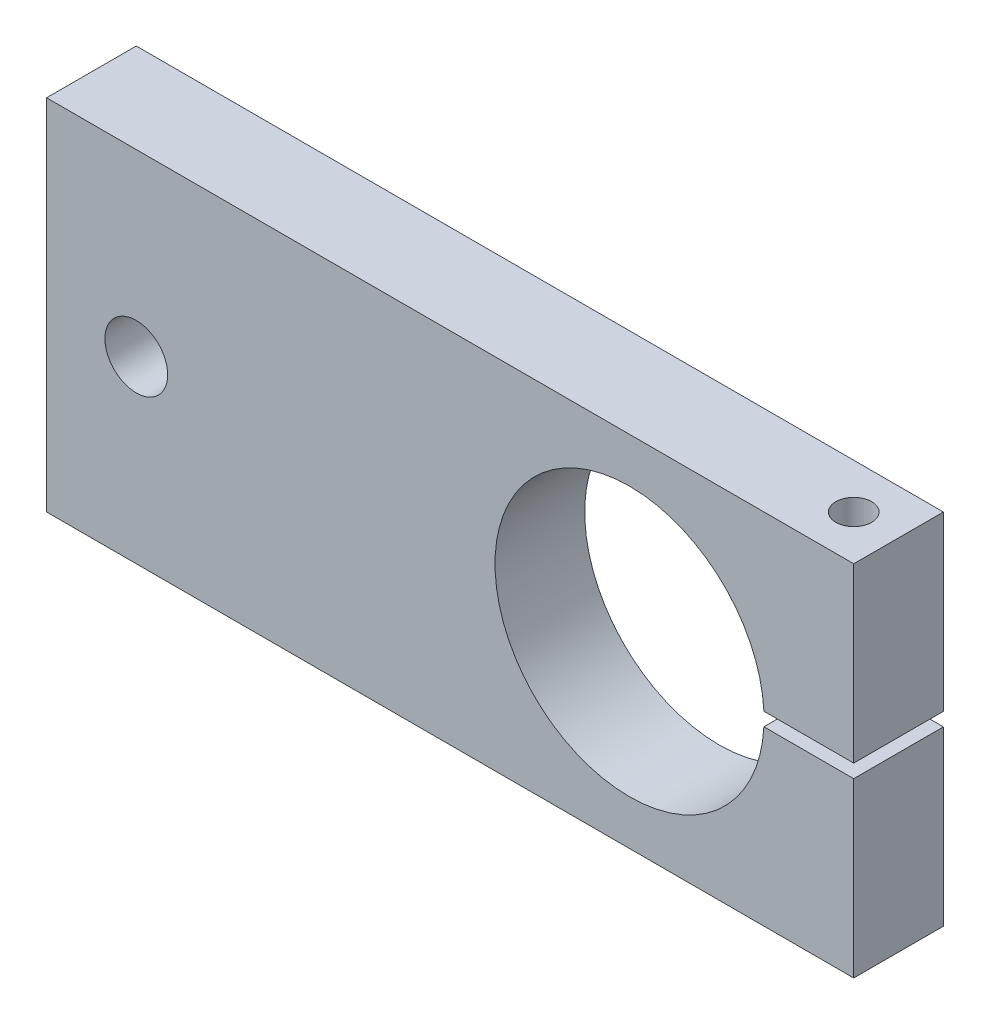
SolidWorks part; units mm, degrees
ref_plane "前视基准面" through (0, 0, 0) normal (0, 0, 1) x (1, 0, 0)
ref_plane "上视基准面" through (0, 0, 0) normal (0, 1, 0) x (1, 0, 0)
ref_plane "右视基准面" through (0, 0, 0) normal (1, 0, 0) x (0, 0, -1)
sketch "草图1" plane through (0, 0, 0) normal (0, 0, 1) x (1, 0, 0)
  line L0 (0, 0) -> (-110, 0) construction
  line L1 (-110, 0) -> (-130, 0) construction
  line L2 (-130, 40) -> (-130, -40)
  line L3 (-130, -40) -> (50, -40)
  line L4 (50, -40) -> (50, 40)
  line L5 (50, 40) -> (-130, 40)
  circle A0 centre (0, 0) radius 30
  circle A1 centre (-110, 0) radius 7
extrude "凸台-拉伸1" add sketch "草图1" along normal blind 20
sketch "草图2" plane through (0, -40, 0) normal (0, -1, 0) x (1, 0, 0)
  line L0 (50, 10) -> (40, 10) construction
  line L1 (50, 20) -> (50, 0) construction
  circle A0 centre (40, 10) radius 4.5
extrude "切除-拉伸1" cut sketch "草图2" against normal blind 40
sketch "草图3" plane through (0, -40, 0) normal (0, -1, 0) x (1, 0, 0)
  circle A0 centre (40, 10) radius 7
extrude "切除-拉伸2" cut sketch "草图3" against normal blind 10
sketch "草图4" plane through (0, 40, 0) normal (0, 1, 0) x (1, 0, 0)
  line L0 (50, -10) -> (40, -10) construction
  line L1 (50, -20) -> (50, 0) construction
  circle A0 centre (40, -10) radius 4
extrude "切除-拉伸3" cut sketch "草图4" against normal blind 40
sketch "草图5" plane through (0, 0, 20) normal (0, 0, 1) x (1, 0, 0)
  line L0 (29.9625, -1.5) -> (67.7848, -1.5)
  line L4 (67.7848, 1.5) -> (67.7848, -1.5)
  line L5 (-67.7848, 1.5) -> (67.7848, -1.5) construction
  line L6 (-67.7848, -1.5) -> (67.7848, 1.5) construction
  line L7 (29.9625, 1.5) -> (67.7848, 1.5)
  circle A0 centre (0, 0) radius 30 construction
  arc A1 (29.9625, -1.5) -> (29.9625, 1.5) centre (0, 0) ccw
  point P0 (0, 0)
  dimension "D1" = 3
extrude "切除-拉伸4" cut sketch "草图5" against normal blind 20
